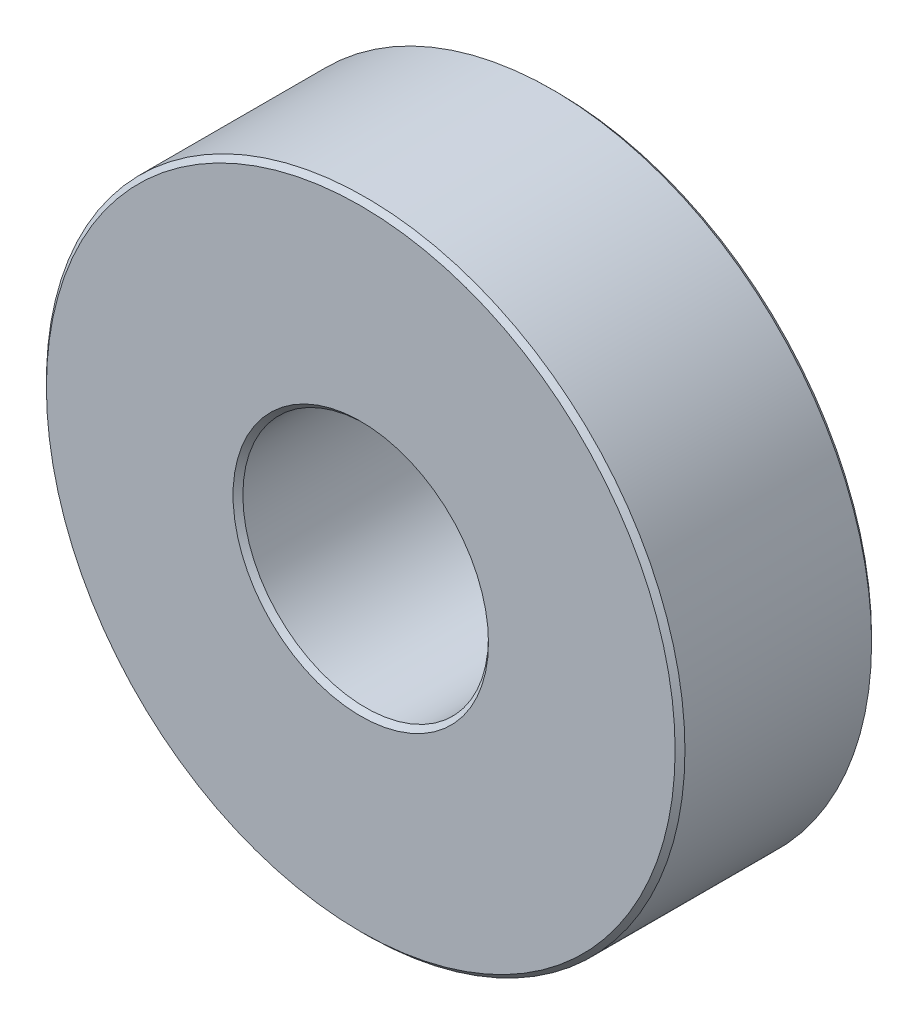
SolidWorks part; units mm, degrees
ref_plane "Plan1" through (0, 0, 0) normal (0, 0, 1) x (1, 0, 0)
ref_plane "Plan2" through (0, 0, 0) normal (0, 1, 0) x (1, 0, 0)
ref_plane "Plan3" through (0, 0, 0) normal (1, 0, 0) x (0, 0, -1)
sketch "Esquisse1" plane through (0, 0, 0) normal (0, 0, 1) x (1, 0, 0)
  circle A0 centre (0, 0) radius 6.5
  dimension "D1" = 13
extrude "Base-Extrusion" add sketch "Esquisse1" along normal blind 4
sketch "Esquisse2" plane through (0, 0, 4) normal (0, 0, 1) x (1, 0, 0)
  circle A0 centre (0, 0) radius 2.5
  dimension "D1" = 5
extrude "Enlèv. mat.-Extru.1" cut sketch "Esquisse2" against normal through all
chamfer "Chanfrein1" distance 0.1 angle 45
